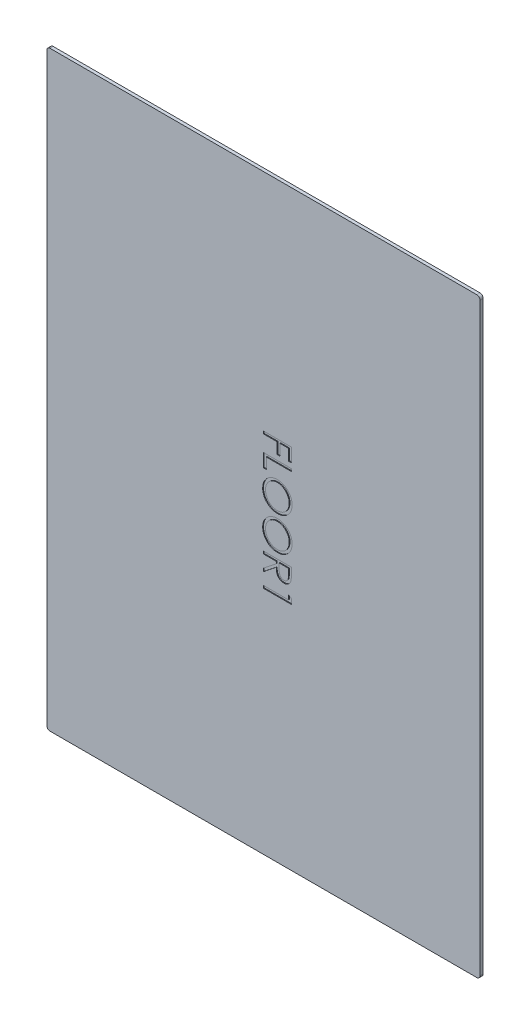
SolidWorks part; units mm, degrees
ref_plane "Plan de face" through (0, 0, 0) normal (0, 0, 1) x (1, 0, 0)
ref_plane "Plan de dessus" through (0, 0, 0) normal (0, 1, 0) x (1, 0, 0)
ref_plane "Plan de droite" through (0, 0, 0) normal (1, 0, 0) x (0, 0, -1)
sketch "Esquisse1" plane through (0, 0, 0) normal (0, 0, 1) x (1, 0, 0)
  line L1 (0, 0) -> (-542, 0)
  line L2 (0, 0) -> (0, -740)
  line L3 (0, -740) -> (-542, -740)
  line L4 (-542, 0) -> (-542, -740)
  dimension "D1" = 740
  dimension "D2" = 542
extrude "Boss.-Extru.1" add sketch "Esquisse1" along normal blind 4
fillet "Congé1" radius 4 4 edges at (0, -740, 2) (-542, -740, 2) (-542, 0, 2) (0, 0, 2)
sketch "Esquisse2" plane through (0, 0, 4) normal (0, 0, 1) x (1, 0, 0)
  line L0 (-271, 0) -> (-271, -740) construction
  line L1 (-4, 0) -> (-538, 0) construction
  line L2 (-538, -740) -> (-4, -740) construction
  text T0 "FLOOR1" font "Century Gothic" height 35
extrude "Enlèv. mat.-Extru.1" cut sketch "Esquisse2" against normal blind 1
